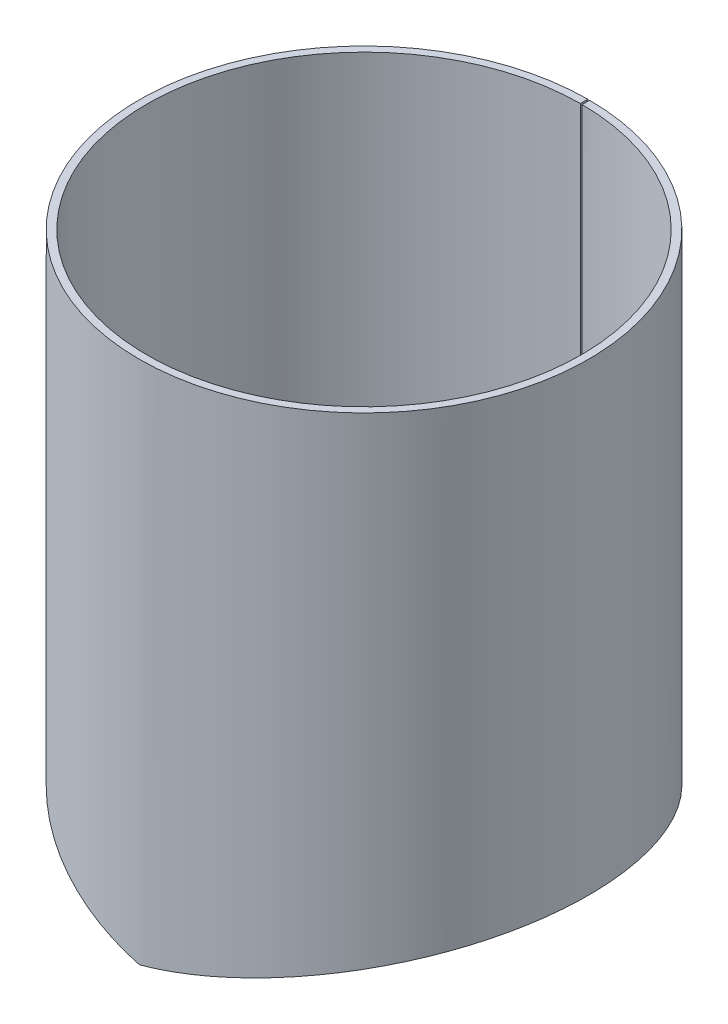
SolidWorks part; units mm, degrees
ref_plane "前视基准面" through (0, 0, 0) normal (0, 0, 1) x (1, 0, 0)
ref_plane "上视基准面" through (0, 0, 0) normal (0, 1, 0) x (1, 0, 0)
ref_plane "右视基准面" through (0, 0, 0) normal (1, 0, 0) x (0, 0, -1)
imported_body "基体零件-Y形管-1"
sheet metal parameters "钣金1" parameters "D1"=0.7366, "厚度"=4
bend "圆角折弯1" bend radius 116 bend angle 359.523 parameters "D5"=1
flatten bends "展开-折弯1" parameters "D1"=0
sketch "尖角-草图1" plane through (-0.5, 140.067, -119.999) normal (-0.0042, 0, -1) x (-1, 0, 0.0042)
  line L0 (363.9414, 139.933) -> (363.9414, -139.933) construction
process bends "加工-折弯1" parameters "D1"=0
sketch "平面-草图1" plane through (-0.5, 140.067, -119.999) normal (-0.0042, 0, -1) x (-1, 0, 0.0042)
